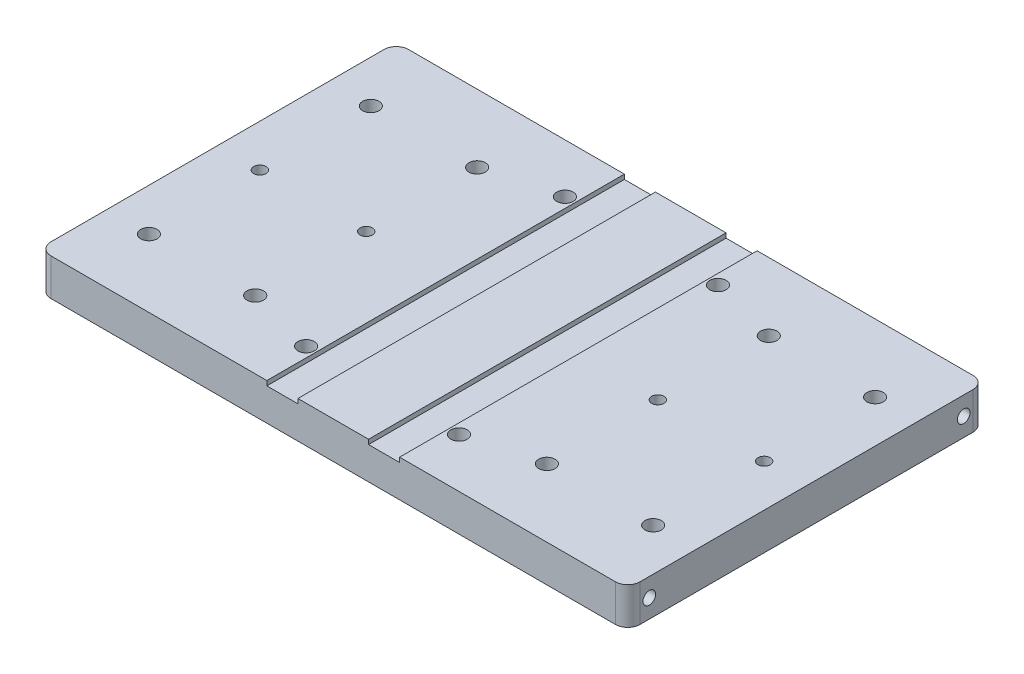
SolidWorks part; units mm, degrees
ref_plane "Front Plane" through (0, 0, 0) normal (0, 0, 1) x (1, 0, 0)
ref_plane "Top Plane" through (0, 0, 0) normal (0, 1, 0) x (1, 0, 0)
ref_plane "Right Plane" through (0, 0, 0) normal (1, 0, 0) x (0, 0, -1)
sketch "Sketch1" plane through (0, 0, 0) normal (0, 1, 0) x (1, 0, 0)
  line L1 (-151.6888, 92.075) -> (151.6888, 92.075)
  line L2 (-151.6888, 92.075) -> (-151.6888, -92.075)
  line L3 (-151.6888, -92.075) -> (151.6888, -92.075)
  line L4 (151.6888, 92.075) -> (151.6888, -92.075)
  line L5 (-151.6888, 92.075) -> (151.6888, -92.075) construction
  line L6 (-151.6888, -92.075) -> (151.6888, 92.075) construction
  point P0 (0, 0)
  dimension "D1" = 303.3776
  dimension "D2" = 184.15
extrude "Boss-Extrude1" add sketch "Sketch1" along normal mid plane 19.05
sketch "Sketch2" plane through (0, 0, -92.075) normal (0, 0, -1) x (-1, 0, 0)
  line L0 (-151.6888, 9.525) -> (151.6888, 9.525) construction
  line L1 (-18.1864, 7.139) -> (-34.1884, 7.139)
  line L2 (-18.1864, 7.139) -> (-18.1864, 9.525)
  line L3 (-18.1864, 9.525) -> (-34.1884, 9.525)
  line L4 (-34.1884, 7.139) -> (-34.1884, 9.525)
  line L5 (-151.6888, 9.525) -> (-151.6888, -9.525) construction
  line L8 (0, -9.525) -> (0, -18.9201) construction
  line L9 (-151.6888, -9.525) -> (151.6888, -9.525) construction
  line L10 (34.1884, 7.139) -> (34.1884, 9.525)
  line L11 (18.1864, 9.525) -> (34.1884, 9.525)
  line L12 (18.1864, 7.139) -> (18.1864, 9.525)
  line L13 (18.1864, 7.139) -> (34.1884, 7.139)
  dimension "D1" = 16.002
  dimension "D2" = 2.386
  dimension "D3" = 117.5004
extrude "Cut-Extrude1" cut sketch "Sketch2" against normal through all
hole_wizard "CBORE for 5/16 Socket Head Cap Screw1" positions "Sketch3" profile "Sketch4" counterbore size "5/16" standard "ANSI Inch"
sketch "Sketch3" plane through (0, -9.525, 0) normal (0, -1, 0) x (-1, 0, 0)
  point P0 (39.3954, 66.675)
  point P3 (39.3954, -66.675)
  point P6 (-39.3954, -66.675)
  point P9 (-39.3954, 66.675)
sketch "Sketch4" plane through (-39.3954, -9.525, -66.675) normal (1, 0, 0) x (0, 0, -1)
  line L0 (0, 0) -> (0, 19.05)
  line L1 (0, 19.05) -> (4.2164, 19.05)
  line L3 (4.2164, 19.05) -> (4.2164, 7.9375)
  line L4 (4.2164, 7.9375) -> (6.7475, 7.9375)
  line L5 (6.7475, 7.9375) -> (6.7475, 0)
  line L7 (6.7475, 0) -> (0, 0)
  line L11 (0, -6.35) -> (0, 107.95) construction
  dimension "Thru Hole Dia." = 8.4328
  dimension "Thru Hole Depth" = 19.05
  dimension "C'Bore Dia." = 13.495
  dimension "C'Bore Depth" = 7.9375
hole_wizard "5/16-18 Tapped Hole1" positions "Sketch5" profile "Sketch6" tap size "5/16-18" standard "ANSI Inch"
sketch "Sketch5" plane through (151.6888, -112.7125, 0) normal (1, 0, 0) x (0, -1, 0)
  line L0 (-103.1875, 0) -> (-88.0842, 0) construction
  line L1 (-103.1875, -92.075) -> (-103.1875, 92.075) construction
  line L3 (-112.7125, 92.075) -> (-112.7125, 80.9625) construction
  line L4 (-122.2375, 92.075) -> (-103.1875, 92.075) construction
  point P0 (-112.7125, -80.9625)
  point P3 (-112.7125, 80.9625)
  dimension "D1" = 11.1125
sketch "Sketch6" plane through (151.6888, 0, 80.9625) normal (0, 1, 0) x (0, 0, -1)
  line L0 (0, 0) -> (0, 22.2811)
  line L1 (0, 22.2811) -> (3.2639, 20.32)
  line L2 (3.2639, 20.32) -> (3.2639, 0)
  line L5 (3.2639, 0) -> (0, 0)
  line L10 (0, 22.2811) -> (-3.2639, 20.32) construction
  line L11 (0, -6.35) -> (0, 107.95) construction
  dimension "Tap Drill Dia." = 6.5278
  dimension "Tap Drill Depth" = 20.32
  dimension "Drill Angle" = 118
hole_wizard "CBORE for 5/16 Socket Head Cap Screw2" positions "Sketch7" profile "Sketch8" counterbore size "5/16" standard "ANSI Inch"
sketch "Sketch7" plane through (0, -9.525, 0) normal (0, -1, 0) x (-1, 0, 0)
  point P0 (75.1078, 57.15)
  point P3 (75.1078, -57.15)
  point P6 (129.8702, -57.15)
  point P9 (129.8702, 57.15)
  point P12 (-129.8702, -57.15)
  point P15 (-129.8702, 57.15)
  point P18 (-75.1078, -57.15)
  point P21 (-75.1078, 57.15)
sketch "Sketch8" plane through (-75.1078, -9.525, -57.15) normal (1, 0, 0) x (0, 0, -1)
  line L0 (0, 0) -> (0, 19.05)
  line L1 (0, 19.05) -> (4.2164, 19.05)
  line L3 (4.2164, 19.05) -> (4.2164, 7.9375)
  line L4 (4.2164, 7.9375) -> (6.7475, 7.9375)
  line L5 (6.7475, 7.9375) -> (6.7475, 0)
  line L7 (6.7475, 0) -> (0, 0)
  line L11 (0, -6.35) -> (0, 107.95) construction
  dimension "Thru Hole Dia." = 8.4328
  dimension "Thru Hole Depth" = 19.05
  dimension "C'Bore Dia." = 13.495
  dimension "C'Bore Depth" = 7.9375
hole_wizard "1/4 (0.2500) Dowel Hole1" positions "Sketch9" profile "Sketch10" hole size "1/4" standard "ANSI Inch"
sketch "Sketch9" plane through (0, 9.525, 0) normal (0, 1, 0) x (1, 0, 0)
  point P0 (129.8702, 0)
  point P3 (75.1078, 0)
  point P6 (-129.8702, 0)
  point P9 (-75.1078, 0)
sketch "Sketch10" plane through (129.8702, 9.525, 0) normal (1, 0, 0) x (0, 0, 1)
  line L0 (0, 0) -> (0, 19.05)
  line L1 (0, 19.05) -> (3.175, 19.05)
  line L2 (3.175, 19.05) -> (3.175, 0)
  line L5 (3.175, 0) -> (0, 0)
  line L11 (0, -6.35) -> (0, 107.95) construction
  dimension "Thru Hole Dia." = 6.35
  dimension "Thru Hole Depth" = 19.05
mirror "Mirror1" about plane through (0, 0, 0) normal (1, 0, 0) of "5/16-18 Tapped Hole1"
fillet "Fillet1" radius 6.35 4 edges at (-151.6888, 0, 92.075) (-151.6888, 0, -92.075) (151.6888, 0, -92.075) (151.6888, 0, 92.075)
